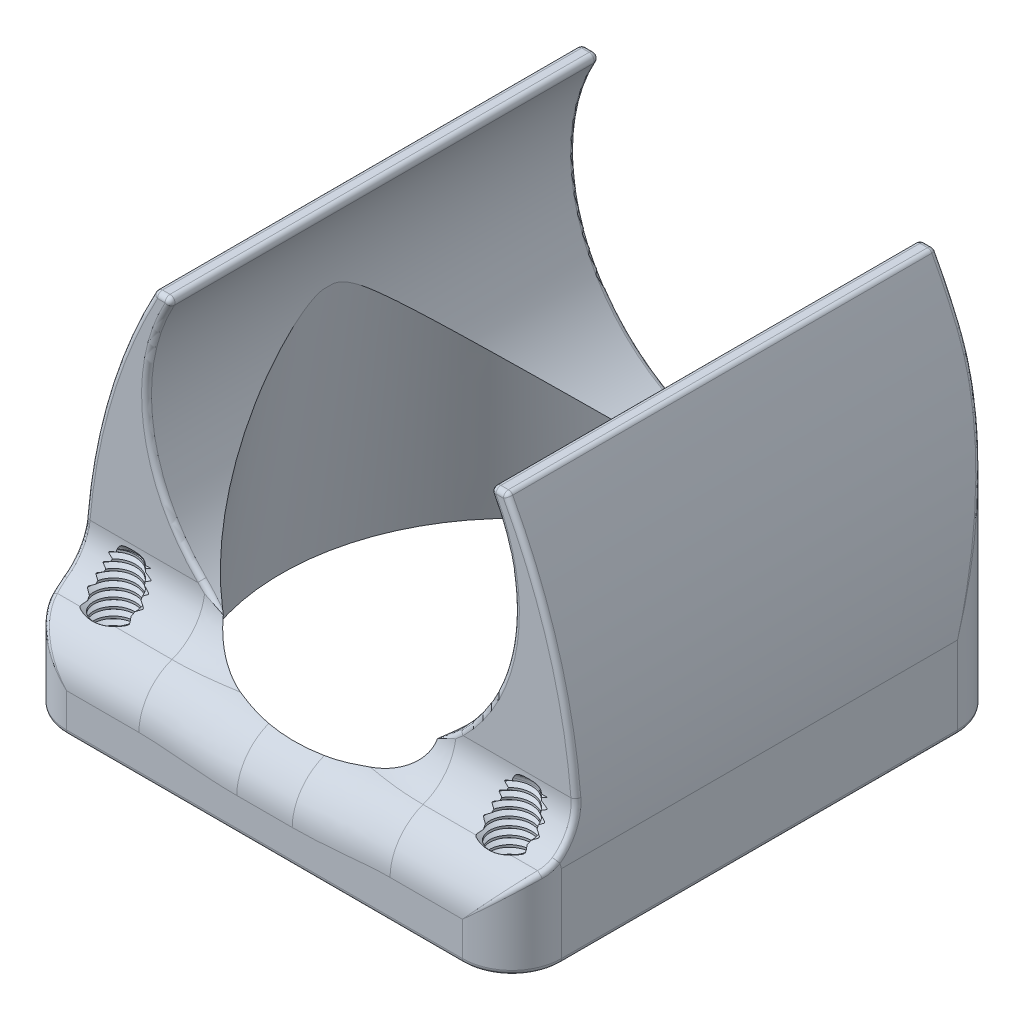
SolidWorks part; units mm, degrees
ref_plane "Front Plane" through (0, 0, 0) normal (0, 0, 1) x (1, 0, 0)
ref_plane "Top Plane" through (0, 0, 0) normal (0, 1, 0) x (1, 0, 0)
ref_plane "Right Plane" through (0, 0, 0) normal (1, 0, 0) x (0, 0, -1)
imported_body "Imported2"
other "DeleteFace2"
other "DeleteFace3"
surface "Surface-Fill1"
surface "Surface-Fill2"
surface "Surface-Knit1"
other "DeleteFace4"
